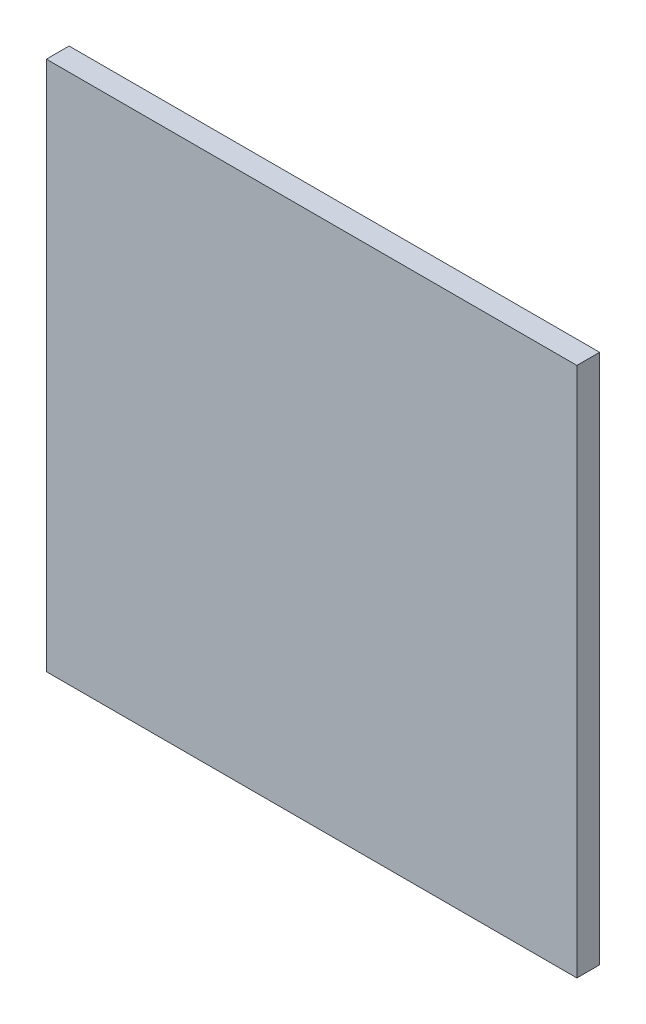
SolidWorks part; units mm, degrees
ref_plane "Plan de face" through (0, 0, 0) normal (0, 0, 1) x (1, 0, 0)
ref_plane "Plan de dessus" through (0, 0, 0) normal (0, 1, 0) x (1, 0, 0)
ref_plane "Plan de droite" through (0, 0, 0) normal (1, 0, 0) x (0, 0, -1)
sketch "Esquisse1" plane through (0, 0, 0) normal (0, 0, 1) x (1, 0, 0)
  line L1 (-35, 35) -> (35, 35)
  line L2 (-35, 35) -> (-35, -35)
  line L3 (-35, -35) -> (35, -35)
  line L4 (35, 35) -> (35, -35)
  line L5 (-35, 35) -> (35, -35) construction
  line L6 (-35, -35) -> (35, 35) construction
  point P0 (0, 0)
  dimension "D1" = 70
  dimension "D2" = 70
extrude "Boss.-Extru.1" add sketch "Esquisse1" along normal blind 3
